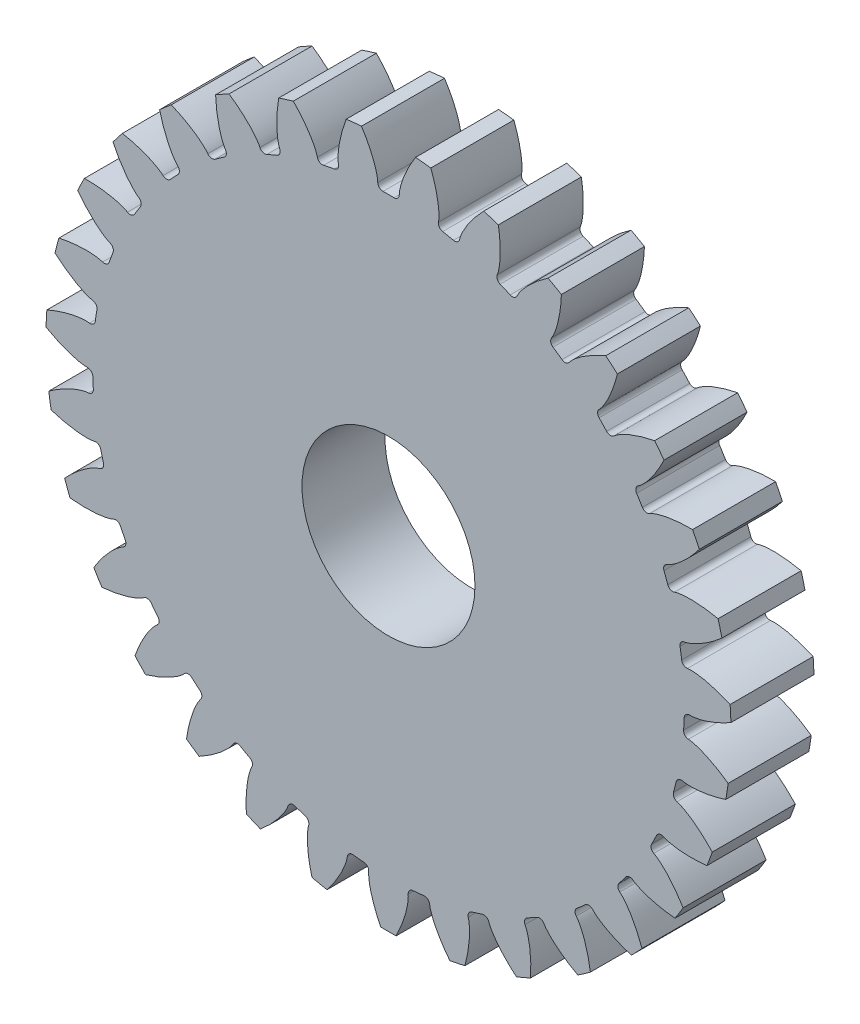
SolidWorks part; units mm, degrees
ref_plane "Face" through (0, 0, 0) normal (0, 0, 1) x (1, 0, 0)
ref_plane "Dessus" through (0, 0, 0) normal (0, 1, 0) x (1, 0, 0)
ref_plane "Droite" through (0, 0, 0) normal (1, 0, 0) x (0, 0, -1)
imported_body "Importée1"
sketch "Esquisse1" plane through (0, 0, 0.9) normal (0, 0, -1) x (-1, 0, 0)
  circle A0 centre (0, 0) radius 4.7485
  dimension "D1" = 9.497
surface "Surface-primitive" sketch "Esquisse1"
